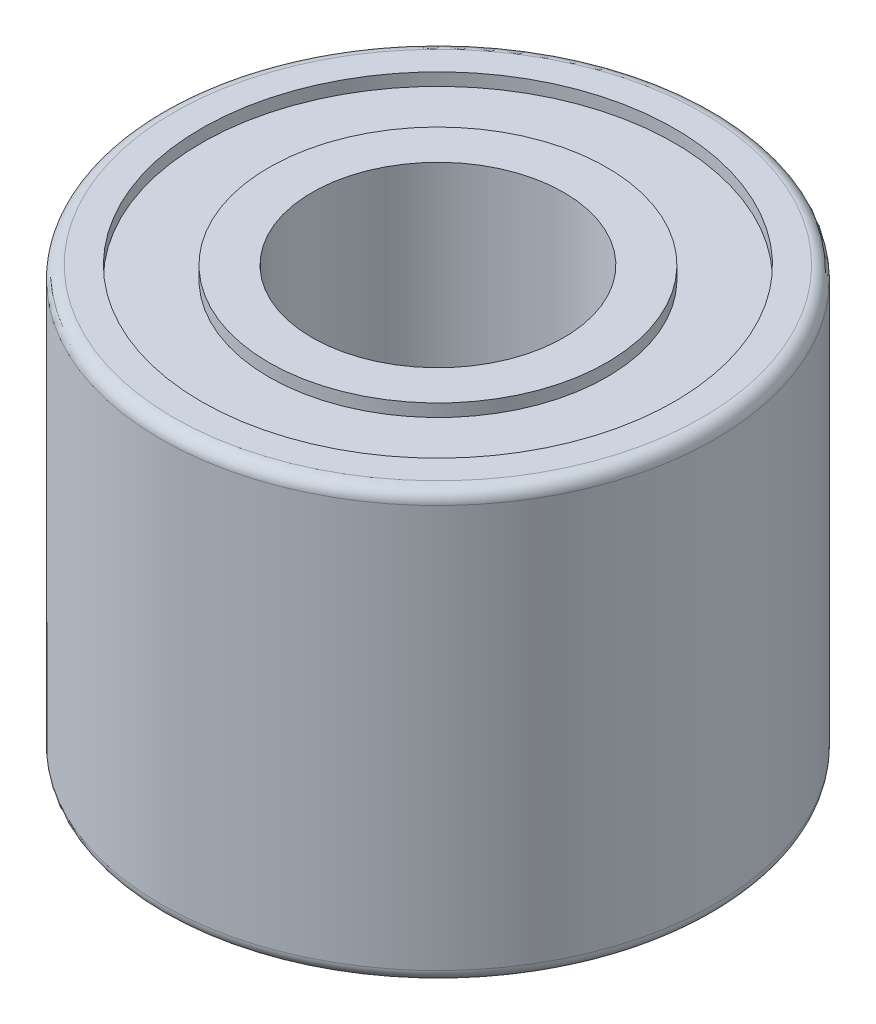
SolidWorks part; units mm, degrees
ref_plane "Front Plane" through (0, 0, 0) normal (0, 0, 1) x (1, 0, 0)
ref_plane "Top Plane" through (0, 0, 0) normal (0, 1, 0) x (1, 0, 0)
ref_plane "Right Plane" through (0, 0, 0) normal (1, 0, 0) x (0, 0, -1)
sketch "Sketch1" plane through (0, 0, 0) normal (0, 1, 0) x (1, 0, 0)
  circle A0 centre (0, 0) radius 5
  circle A1 centre (0, 0) radius 6.715
  dimension "D1" = 10
  dimension "D2" = 13.43
extrude "Boss-Extrude1" add sketch "Sketch1" along normal blind 17
ref_plane "Plane1" through (0, 8.5, 0) normal (0, 1, 0) x (1, 0, 0)
sketch "Sketch4" plane through (0, 8.5, 0) normal (0, 1, 0) x (1, 0, 0)
  circle A0 centre (0, 0) radius 9.4
  dimension "D1" = 18.8
extrude "Boss-Extrude2" add sketch "Sketch4" along normal mid plane 16
sketch "Sketch7" plane through (0, 17, 0) normal (0, 1, 0) x (1, 0, 0)
  circle A0 centre (0, 0) radius 11
  circle A1 centre (0, 0) radius 9.4
  dimension "D1" = 22
  dimension "D2" = 18.8
extrude "Boss-Extrude3" add sketch "Sketch7" against normal blind 17
sketch "Sketch8" plane through (0, 0.5, 0) normal (0, -1, 0) x (1, 0, 0)
  circle A0 centre (0, 0) radius 5
  dimension "D1" = 10
extrude "Cut-Extrude1" cut sketch "Sketch8" against normal blind 17
fillet "Fillet1" radius 0.5 2 edges at (0, 0, 11) (0, 17, 11)
